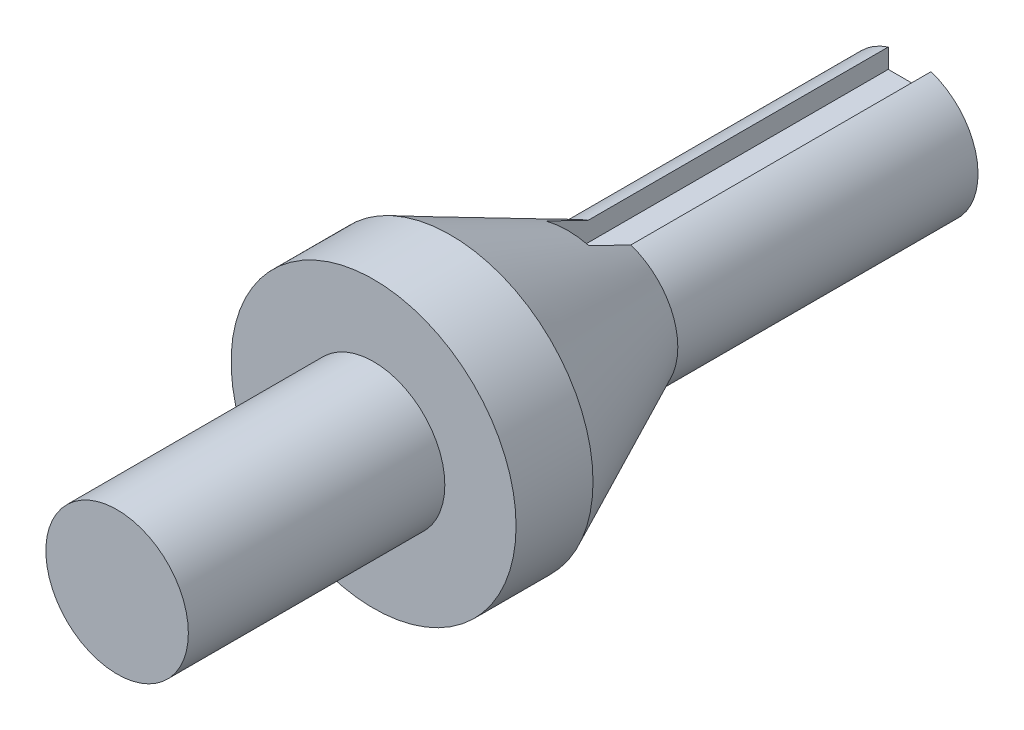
SolidWorks part; units mm, degrees
ref_plane "Top Plane" through (0, 0, 0) normal (0, 0, 1) x (1, 0, 0)
ref_plane "Front Plane" through (0, 0, 0) normal (0, 1, 0) x (1, 0, 0)
ref_plane "Right Plane" through (0, 0, 0) normal (1, 0, 0) x (0, 0, -1)
sketch "Sketch1" plane through (0, 0, 0) normal (1, 0, 0) x (0, 0, -1)
  line L0 (-14.4823, 0) -> (14.4823, 0) construction
  line L1 (-13.905, 0) -> (-13.905, 2.5)
  line L2 (-13.905, 2.5) -> (-4.905, 2.5)
  line L3 (-4.905, 2.5) -> (-4.905, 5)
  line L4 (-4.905, 5) -> (-2.205, 5)
  line L5 (-2.205, 5) -> (3.3707, 2.4)
  line L6 (3.3707, 2.4) -> (13.905, 2.4)
  line L7 (13.905, 2.4) -> (13.905, 0)
  line L8 (13.905, 0) -> (-13.905, 0)
  point P4 (0, 0)
  point P16 (0, 0)
  dimension "D1" = 5
  dimension "D2" = 4.8
  dimension "D3" = 10
  dimension "D4" = 2.7
  dimension "D5" = 25
  dimension "D6" = 18.81
  dimension "D7" = 9
revolve "Revolve1" add sketch "Sketch1" angle 360 about L0
thread "Thread1" pitch 0.8 start angle 0, offset 0, length 10.2, pitch 0.8, diameter 4.8
ref_plane "Plane1" through (2.4, 0, -13.905) normal (0, -1, 0) x (1, 0, 0)
sketch "Thread Profile1" plane through (2.4, 0, -13.905) normal (0, -1, 0) x (1, 0, 0)
  line L0 (0, 0) -> (0, 0.8) construction
  line L11 (0, 0) -> (0, 0.7)
  line L12 (0, 0.7) -> (-0.433, 0.45)
  line L13 (-0.433, 0.45) -> (-0.433, 0.25)
  line L15 (-0.433, 0.25) -> (0, 0)
  line L17 (-0.433, 0.35) -> (0, 0.35) construction
  point P2 (0, 0)
  dimension "Pitch" = 0.8
  dimension "Profile_Angle" = 60
  dimension "Profile_Land" = 0.2
  dimension "Profile_Height" = 0.433
sketch "Sketch2" plane through (0, 0, -13.905) normal (0, 0, -1) x (-1, 0, 0)
  line L0 (0, 0) -> (0, 6.2152) construction
  line L2 (-0.75, 3.1) -> (0.75, 3.1)
  line L3 (-0.75, 3.1) -> (-0.75, 1.6)
  line L4 (-0.75, 1.6) -> (0.75, 1.6)
  line L5 (0.75, 3.1) -> (0.75, 1.6)
  line L6 (-0.75, 3.1) -> (0.75, 1.6) construction
  line L7 (-0.75, 1.6) -> (0.75, 3.1) construction
  circle A0 centre (0, 0) radius 2.4 construction
  point P3 (0, 2.35)
  point P8 (0, 1.6)
  dimension "D1" = 1.5
  dimension "D2" = 1.6
extrude "Cut-Extrude1" cut sketch "Sketch2" against normal blind 12
